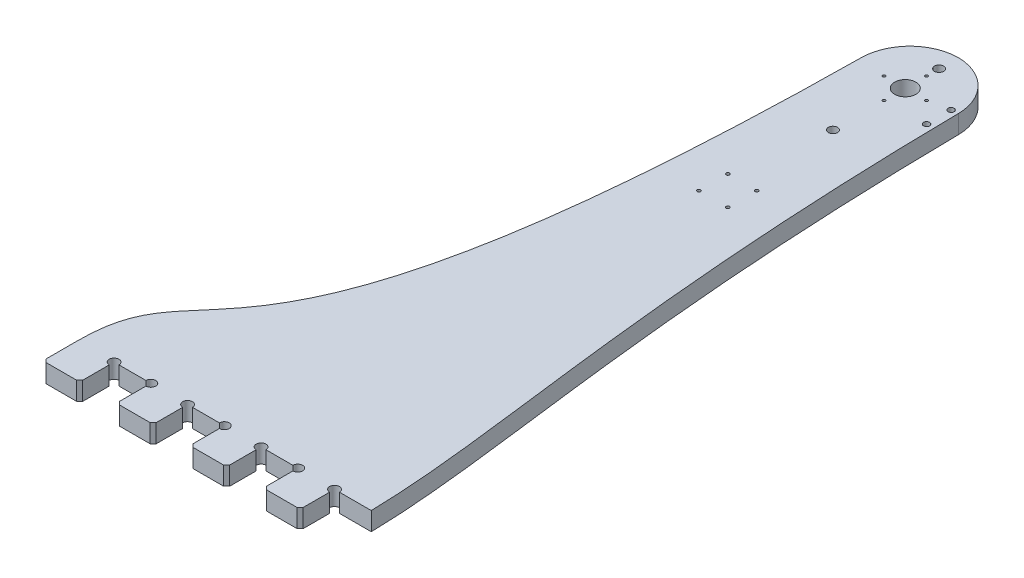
SolidWorks part; units mm, degrees
ref_plane "Front Plane" through (0, 0, 0) normal (0, 0, 1) x (1, 0, 0)
ref_plane "Top Plane" through (0, 0, 0) normal (0, 1, 0) x (1, 0, 0)
ref_plane "Right Plane" through (0, 0, 0) normal (1, 0, 0) x (0, 0, -1)
sketch "support panel" plane through (0, 0, 0) normal (0, 1, 0) x (1, 0, 0)
  line L0 (0, 0) -> (304.8, 0)
  line L1 (152.4, 0) -> (152.4, 711.2) construction
  line L2 (152.4, 711.2) -> (252.3998, 711.2)
  line L3 (252.3998, 711.2) -> (252.3998, 326.0565) construction
  line L4 (252.3998, 326.0565) -> (301.7247, 149.3205) construction
  line L5 (301.7247, 149.3205) -> (304.8, 0) construction
  line L6 (152.4, 711.2) -> (152.4, 0) construction
  line L7 (202.3999, 711.2) -> (202.3999, 457.2) construction
  line L8 (152.4, 0) -> (-0.3035, 154.7816) construction
  line L9 (-0.3035, 154.7816) -> (0, 0) construction
  circle A0 centre (202.3999, 691.2) radius 4.7625
  circle A1 centre (202.3999, 581.2) radius 4.7625
  circle A2 centre (202.3999, 656.2) radius 11
  circle A3 centre (202.3999, 678.2) radius 1.5
  circle A4 centre (224.3999, 656.2) radius 1.5
  circle A5 centre (202.3999, 634.2) radius 1.5
  circle A6 centre (180.3999, 656.2) radius 1.5
  circle A7 centre (245.6686, 660.4) radius 3.175
  circle A8 centre (245.6686, 635) radius 3.175
  circle A9 centre (187.3999, 457.2) radius 1.75
  circle A10 centre (217.3999, 457.2) radius 1.75
  circle A11 centre (217.3999, 487.2) radius 1.75
  circle A12 centre (187.3999, 487.2) radius 1.75
  spline S0 degree 3 poles (252.3998, 711.2) (252.3998, 326.0565) (301.7247, 149.3205) (304.8, 0) knots 0 0 0 0 1 1 1 1
  spline S1 degree 3 poles (152.4, 711.2) (152.4, 0) (-0.3035, 154.7816) (0, 0) knots 0 0 0 0 1 1 1 1
  point P13 (152.4, 0)
  point P16 (126.3336, 676.9224)
  point P17 (202.3999, 707)
  point P33 (202.3999, 656.2)
  dimension "D7" = 9.525
  dimension "D9" = 22
  dimension "D10" = 3
  dimension "D13" = 2
  dimension "D14" = 15
  dimension "D15" = 3.5
  dimension "D17" = 20
  dimension "D1" = 711.2
  dimension "D2" = 304.8
  dimension "D3" = 99.9998
  dimension "D4" = 254
  dimension "D11" = 22
  dimension "D18" = 35
  dimension "D19" = 75
  dimension "D20" = 50.8
  dimension "D8" = 2
  dimension "D16" = 2
  dimension "D12" = 4
extrude "side panel" add sketch "support panel" along normal blind 19.05
sketch "tabs" plane through (0, 19.05, 0) normal (0, 1, 0) x (1, 0, 0)
  line L0 (76.2, 0) -> (114.3, 0)
  line L1 (0, 0) -> (38.1, 0)
  line L2 (0, 0) -> (0, -35.7)
  line L3 (0, -35.7) -> (38.1, -35.7)
  line L4 (38.1, 0) -> (38.1, -35.7)
  line L5 (76.2, 0) -> (76.2, -35.7)
  line L6 (76.2, -35.7) -> (114.3, -35.7)
  line L7 (114.3, 0) -> (114.3, -35.7)
  line L8 (152.4, 0) -> (190.5, 0)
  line L9 (152.4, 0) -> (152.4, -35.7)
  line L10 (152.4, -35.7) -> (190.5, -35.7)
  line L11 (190.5, 0) -> (190.5, -35.7)
  line L12 (228.6, 0) -> (266.7, 0)
  line L13 (228.6, 0) -> (228.6, -35.7)
  line L14 (228.6, -35.7) -> (266.7, -35.7)
  line L15 (266.7, 0) -> (266.7, -35.7)
  dimension "D1" = 35.7
  dimension "D2" = 38.1
  dimension "D3" = 4
extrude "tabsx" add sketch "tabs" against normal up to surface (19.05 mm away)
chamfer "pressfit" distance 3.175 angle 45 8 edges at (266.7, 9.525, 35.7) (228.6, 9.525, 35.7) (190.5, 9.525, 35.7) (152.4, 9.525, 35.7) (114.3, 9.525, 35.7) (76.2, 9.525, 35.7) (38.1, 9.525, 35.7) (0, 9.525, 35.7)
sketch "ShopBot Considerations" plane through (0, 19.05, 0) normal (0, 1, 0) x (1, 0, 0)
  circle A0 centre (38.1, 0) radius 5.08
  circle A1 centre (76.2, 0) radius 5.08
  circle A2 centre (114.3, 0) radius 5.08
  circle A3 centre (152.4, 0) radius 5.08
  circle A4 centre (190.5, 0) radius 5.08
  circle A5 centre (228.6, 0) radius 5.08
  circle A6 centre (266.7, 0) radius 5.08
  dimension "D1" = 7
extrude "SB consideration" cut sketch "ShopBot Considerations" against normal up to next
fillet "Fillet1" radius 50.8 2 edges at (152.4, 9.525, -711.2) (252.3998, 9.525, -711.2)
